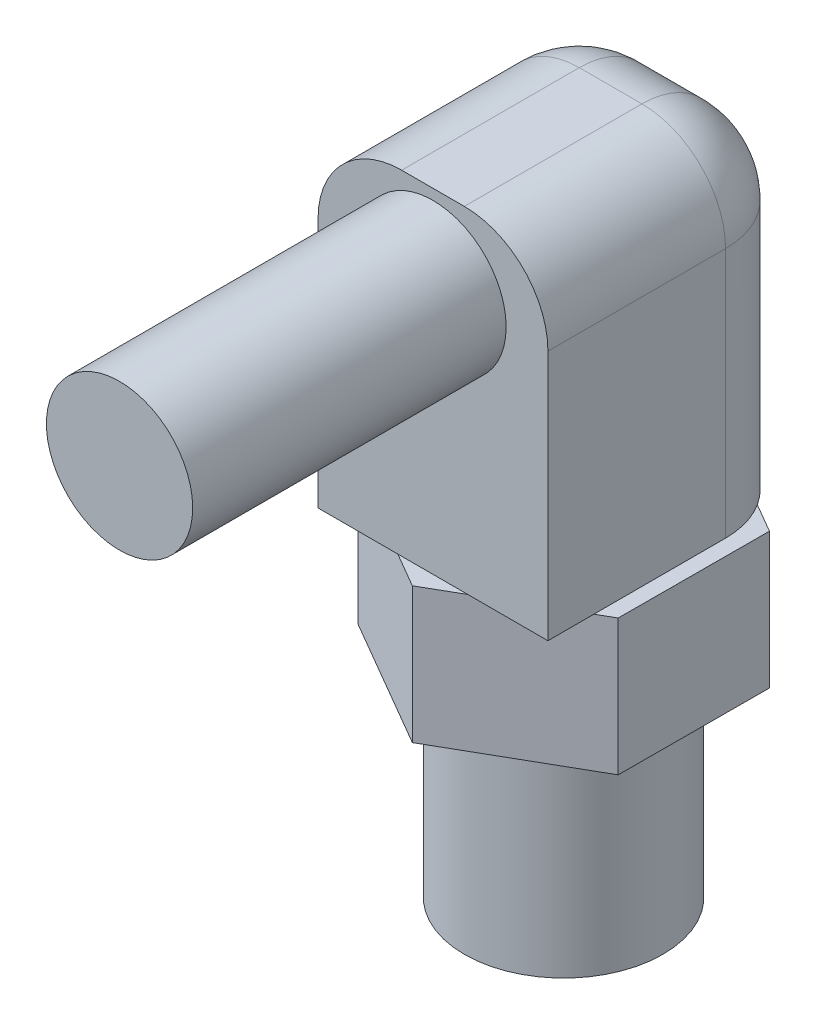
SolidWorks part; units mm, degrees
ref_plane "Front Plane" through (0, 0, 0) normal (0, 0, 1) x (1, 0, 0)
ref_plane "Top Plane" through (0, 0, 0) normal (0, 1, 0) x (1, 0, 0)
ref_plane "Right Plane" through (0, 0, 0) normal (1, 0, 0) x (0, 0, -1)
sketch "Sketch1" plane through (0, 0, 0) normal (0, 0, 1) x (1, 0, 0)
  line L0 (0, 0) -> (0, 4.064) construction
  line L1 (-2.794, 4.064) -> (2.794, 4.064)
  line L2 (2.794, 4.064) -> (2.794, -4.064)
  line L3 (-2.794, 4.064) -> (-2.794, -4.064)
  line L4 (0, 0) -> (2.794, 0) construction
  line L5 (-2.794, -4.064) -> (2.794, -4.064)
  point P9 (-2.794, 0)
  dimension "D1" = 2.794
  dimension "D2" = 4.064
extrude "cube" add sketch "Sketch1" along normal blind 6.35
sketch "Sketch2" plane through (0, 0, 6.35) normal (0, 0, 1) x (1, 0, 0)
  line L1 (2.794, 4.064) -> (-2.794, 4.064) construction
  circle A0 centre (0, 2.032) radius 1.778
  dimension "D1" = 3.556
  dimension "D2" = 2.032
extrude "hose_barb" add sketch "Sketch2" along normal blind 7.62
sketch "Sketch3" plane through (0, -4.064, 0) normal (0, -1, 0) x (1, 0, 0)
  line L0 (0, 0) -> (0, 6.35) construction
  line L1 (1.778, 6.35) -> (-1.778, 6.35) construction
  line L3 (-3.1803, 4.9989) -> (-3.1697, 1.3327)
  line L4 (-3.1697, 1.3327) -> (0.0106, -0.4912)
  line L5 (0.0106, -0.4912) -> (3.1803, 1.3511)
  line L6 (3.1803, 1.3511) -> (3.1697, 5.0173)
  line L7 (3.1697, 5.0173) -> (-0.0106, 6.8412)
  line L8 (-0.0106, 6.8412) -> (-3.1803, 4.9989)
  circle A0 centre (0, 3.175) radius 3.175 construction
  dimension "D1" = 6.35
extrude "hex" add sketch "Sketch3" along normal blind 3.302
sketch "Sketch4" plane through (0, -7.366, 0) normal (0, -1, 0) x (1, 0, 0)
  line L0 (0, 0) -> (0, 6.35) construction
  circle A0 centre (0, 3.175) radius 2.413
  dimension "D1" = 4.826
extrude "10-32 thread" add sketch "Sketch4" along normal blind 5.08
fillet "Fillet1" radius 2.032 3 edges at (-2.794, 4.064, 3.175) (0, 4.064, 0) (2.794, 4.064, 3.175)
fillet "Fillet3" radius 2.032 4 edges at (-2.1988, 3.4688, 0.5952) (2.1988, 3.4688, 0.5952) (-2.794, -1.016, 0) (2.794, -1.016, 0)
